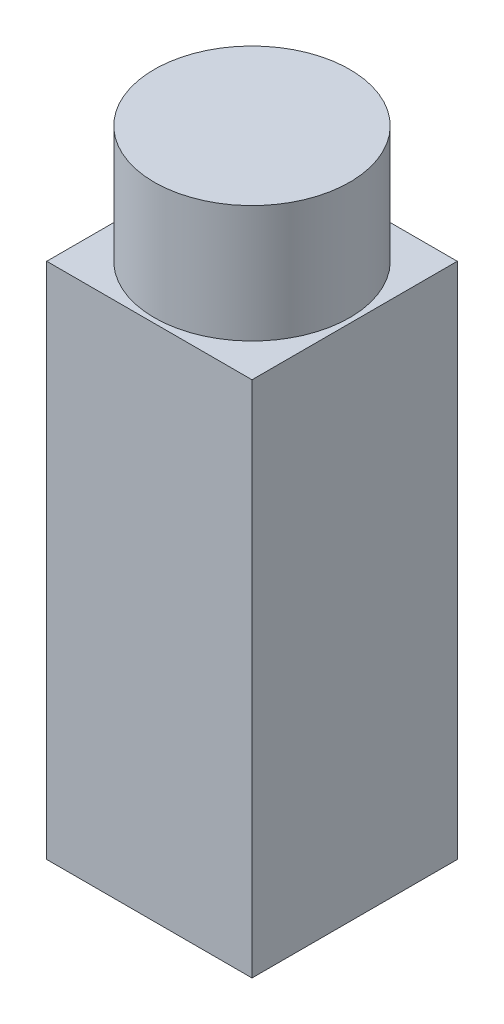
SolidWorks part; units mm, degrees
ref_plane "Ebene vorne" through (0, 0, 0) normal (0, 0, 1) x (1, 0, 0)
ref_plane "Ebene oben" through (0, 0, 0) normal (0, 1, 0) x (1, 0, 0)
ref_plane "Ebene rechts" through (0, 0, 0) normal (1, 0, 0) x (0, 0, -1)
sketch "Skizze2" plane through (0, 0, 0) normal (0, 1, 0) x (1, 0, 0)
  line L5 (-2, 2) -> (8.5, 2)
  line L6 (-2, 2) -> (-2, -8.5)
  line L7 (-2, -8.5) -> (8.5, -8.5)
  line L8 (8.5, 2) -> (8.5, -8.5)
  dimension "D3" = 10.5
  dimension "D4" = 10.5
extrude "Aufsatz-Linear austragen1" add sketch "Skizze2" along normal blind 26.5
sketch "Skizze3" plane through (0, 0, 0) normal (0, -1, 0) x (-1, 0, 0)
  line L1 (0, -6.5) -> (-6.5, -6.5)
  line L2 (0, -6.5) -> (0, 0)
  line L3 (0, 0) -> (-6.5, 0)
  line L4 (-6.5, -6.5) -> (-6.5, 0)
  line L6 (-8.5, 2) -> (2, 2) construction
  line L7 (-8.5, -8.5) -> (-8.5, 2) construction
  dimension "D1" = 6.5
  dimension "D2" = 6.5
  dimension "D3" = 2
  dimension "D4" = 2
extrude "Schnitt-Linear austragen1" cut sketch "Skizze3" against normal blind 3
sketch "Skizze4" plane through (0, 26.5, 0) normal (0, 1, 0) x (1, 0, 0)
  line L0 (8.5, -8.5) -> (8.5, 2) construction
  line L2 (8.5, 2) -> (-2, 2) construction
  circle A0 centre (3.25, -3.25) radius 5
  dimension "D1" = 10
  dimension "D2" = 5.25
  dimension "D3" = 5.25
extrude "Aufsatz-Linear austragen2" add sketch "Skizze4" along normal blind 6
